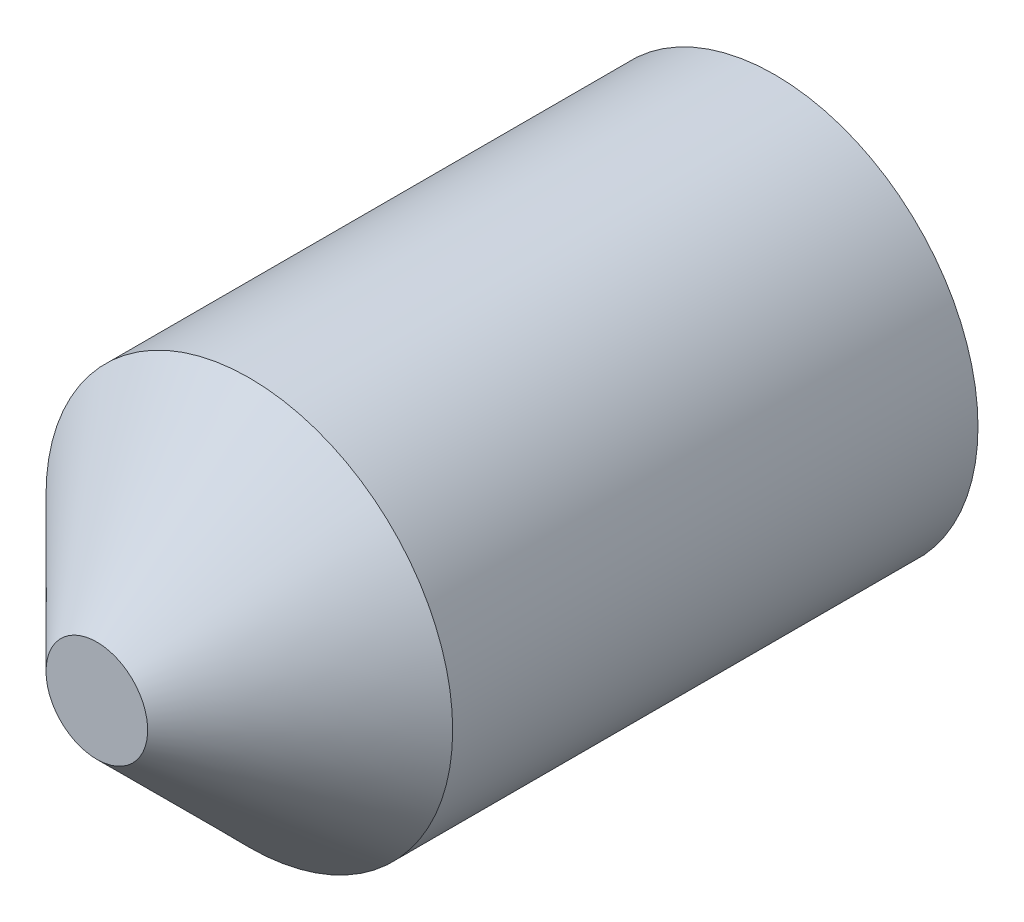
SolidWorks part; units mm, degrees
ref_plane "Plan de face" through (0, 0, 0) normal (0, 0, 1) x (1, 0, 0)
ref_plane "Plan de dessus" through (0, 0, 0) normal (0, 1, 0) x (1, 0, 0)
ref_plane "Plan de droite" through (0, 0, 0) normal (1, 0, 0) x (0, 0, -1)
sketch "Esquisse1" plane through (0, 0, 0) normal (0, 0, 1) x (1, 0, 0)
  circle A0 centre (0, 0) radius 3
  dimension "D1" = 6
extrude "Extrusion1" add sketch "Esquisse1" along normal blind 10
chamfer "Chanfrein2" distance 2.25 angle 45 1 edges at (3, 0, 10)
sketch "Esquisse2" plane through (0, 0, 0) normal (0, 0, -1) x (-1, 0, 0)
  line L1 (0, -1.7321) -> (1.5, -0.866)
  line L2 (1.5, -0.866) -> (1.5, 0.866)
  line L3 (1.5, 0.866) -> (0, 1.7321)
  line L4 (0, 1.7321) -> (-1.5, 0.866)
  line L5 (-1.5, 0.866) -> (-1.5, -0.866)
  line L6 (-1.5, -0.866) -> (0, -1.7321)
  circle A0 centre (0, 0) radius 1.5 construction
  dimension "D1" = 3
extrude "Enlèv. mat.-Extru.1" cut sketch "Esquisse2" against normal blind 3
